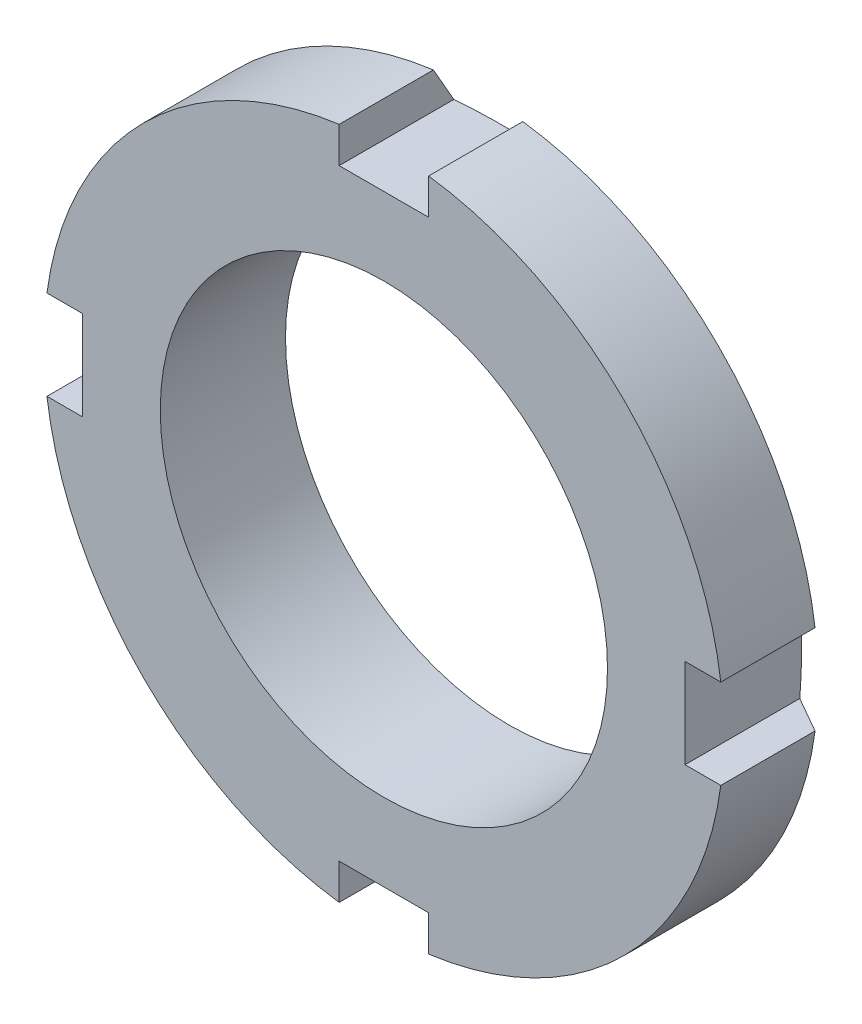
SolidWorks part; units mm, degrees
ref_plane "Face" through (0, 0, 0) normal (0, 0, 1) x (1, 0, 0)
ref_plane "Dessus" through (0, 0, 0) normal (0, 1, 0) x (1, 0, 0)
ref_plane "Droite" through (0, 0, 0) normal (1, 0, 0) x (0, 0, -1)
sketch "Esquisse1" plane through (0, 0, 0) normal (1, 0, 0) x (0, 0, -1)
  line L0 (0, 0) -> (-2, 0) construction
  line L1 (0, 12.5) -> (0, 16)
  line L2 (0, 16) -> (-1.7321, 19)
  line L3 (-1.7321, 19) -> (-7, 19)
  line L4 (-7, 19) -> (-7, 12.5)
  line L5 (-7, 12.5) -> (0, 12.5)
  line L6 (0, 12.5) -> (0, -12.5) construction
  dimension "D2" = 30
  dimension "h" = 7
  dimension "dn" = 25
  dimension "D" = 38
  dimension "d1" = 32
revolve "Base-Révolution" add sketch "Esquisse1" angle 360 about L0
sketch "Esquisse2" plane through (0, 0, 0) normal (0, 0, 1) x (1, 0, 0)
  line L0 (0, 0) -> (0, 16.8348) construction
  line L1 (0, 0) -> (16.8348, 0) construction
  line L2 (-2.5, 16.8348) -> (2.5, 16.8348)
  line L3 (16.8348, 2.5) -> (16.8348, -2.5)
  line L4 (2.5, 16.8348) -> (2.5, 18.8348)
  line L5 (-2.5, 16.8348) -> (-2.5, 18.8348)
  line L6 (16.8348, 2.5) -> (18.8348, 2.5)
  line L7 (16.8348, -2.5) -> (18.8348, -2.5)
  line L8 (-16.8348, -2.5) -> (-18.8348, -2.5)
  line L9 (-16.8348, 2.5) -> (-18.8348, 2.5)
  line L10 (-16.8348, 2.5) -> (-16.8348, -2.5)
  line L11 (-2.5, -16.8348) -> (-2.5, -18.8348)
  line L12 (2.5, -16.8348) -> (2.5, -18.8348)
  line L13 (-2.5, -16.8348) -> (2.5, -16.8348)
  circle A0 centre (0, 0) radius 19 construction
  arc A1 (18.8348, 2.5) -> (2.5, 18.8348) centre (0, 0) ccw
  arc A2 (-2.5, 18.8348) -> (-18.8348, 2.5) centre (0, 0) ccw
  arc A3 (-18.8348, -2.5) -> (-2.5, -18.8348) centre (0, 0) ccw
  arc A4 (2.5, -18.8348) -> (18.8348, -2.5) centre (0, 0) ccw
  dimension "g" = 5
  dimension "f" = 2
extrude "Enlèv. mat.-Extru.2" cut sketch "Esquisse2" along normal through all flip side to cut
